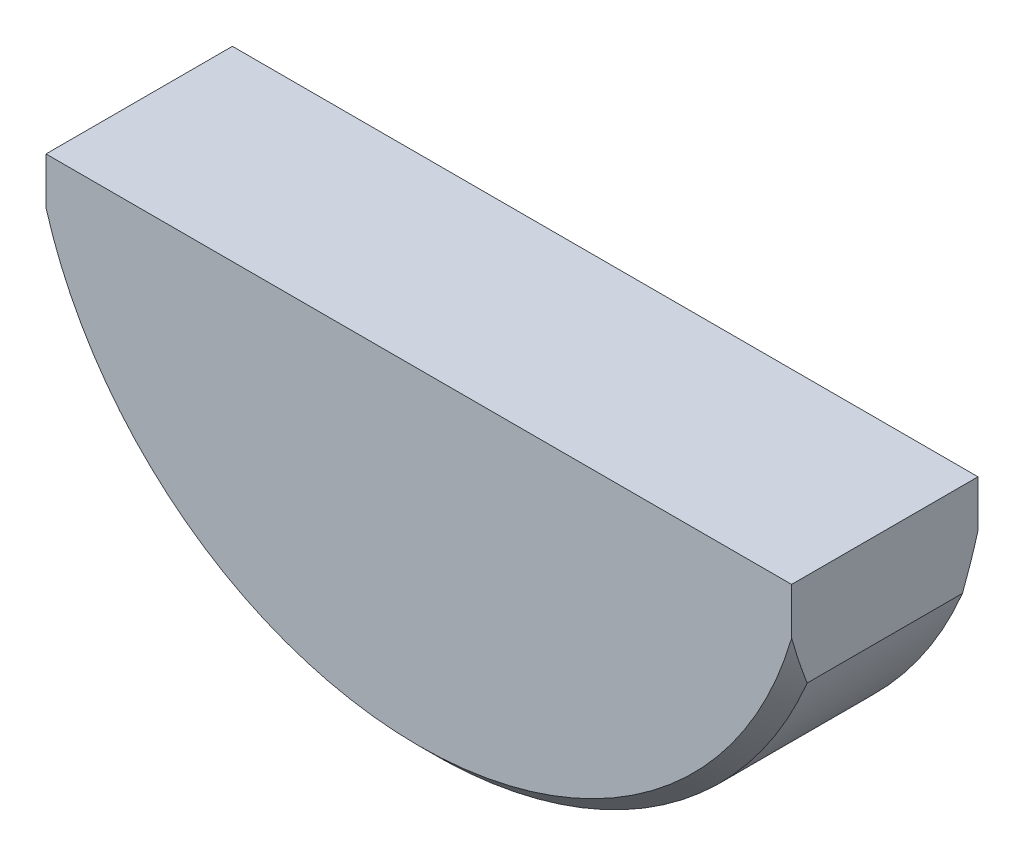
SolidWorks part; units mm, degrees
ref_plane "Plan1" through (0, 0, 0) normal (0, 0, 1) x (1, 0, 0)
ref_plane "Plan2" through (0, 0, 0) normal (0, 1, 0) x (1, 0, 0)
ref_plane "Plan3" through (0, 0, 0) normal (1, 0, 0) x (0, 0, -1)
sketch "Esquisse1" plane through (0, 0, 0) normal (0, 0, 1) x (1, 0, 0)
  line L0 (-24, 30) -> (-24, 24)
  line L1 (-24, 30) -> (24, 30)
  line L2 (24, 30) -> (24, 24)
  arc A0 (-24, 24) -> (24, 24) centre (0, 34) ccw
  dimension "D2" = 52
  dimension "D1" = 34
  dimension "D3" = 4
  dimension "D4" = 24
  dimension "D5" = 24
extrude "Base-Extrusion" add sketch "Esquisse1" along normal mid plane 12
chamfer "Chanfrein1" distance 1 angle 45
